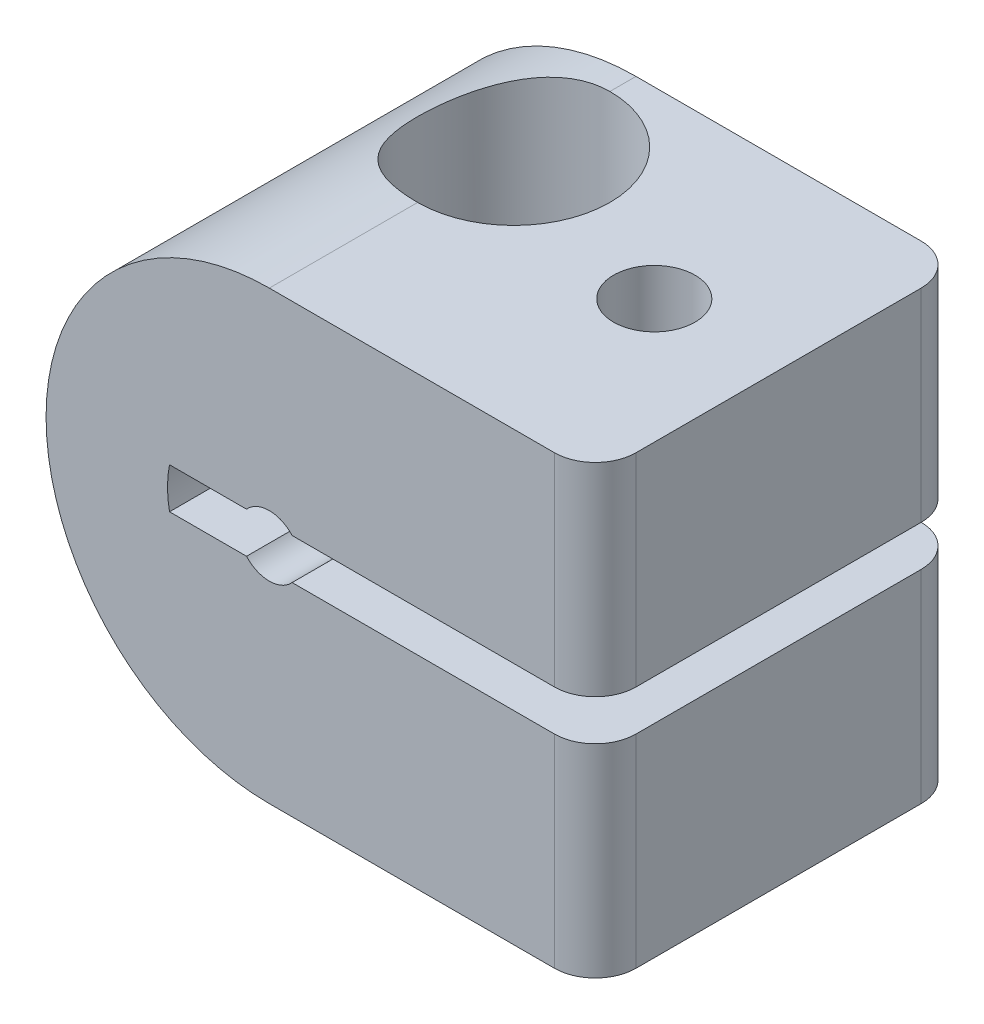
SolidWorks part; units mm, degrees
ref_plane "WL" through (0, 0, 0) normal (0, 0, 1) x (1, 0, 0)
ref_plane "BL" through (0, 0, 0) normal (0, 1, 0) x (1, 0, 0)
ref_plane "STA" through (0, 0, 0) normal (1, 0, 0) x (0, 0, -1)
sketch "Sketch1" plane through (0, 0, 0) normal (0, 0, 1) x (1, 0, 0)
  line L1 (0, 6.9596) -> (10.16, 6.9596)
  line L3 (10.16, 6.9596) -> (10.16, -6.9596)
  line L4 (0, -6.9596) -> (10.16, -6.9596)
  arc A1 (0, 6.9596) -> (0, -6.9596) centre (0, 0) ccw
  dimension "D4" = 13.9192
extrude "Boss-Extrude1" add sketch "Sketch1" along normal blind 5.08
sketch "Sketch6" plane through (0, 0, 5.08) normal (0, 0, 1) x (1, 0, 0)
  circle A0 centre (0, 0) radius 0.9525
  dimension "D1" = 1.905
extrude "Cut-Extrude4" cut sketch "Sketch6" against normal blind 8.89
sketch "Sketch2" plane through (0, 0, 0) normal (0, 0, -1) x (-1, 0, 0)
  line L1 (0, 0) -> (12.8833, 0) construction
  line L4 (-10.16, 6.9596) -> (0, 6.9596) construction
  line L5 (-10.16, -6.9596) -> (-10.16, 6.9596) construction
  line L6 (0, -6.9596) -> (-10.16, -6.9596) construction
  line L7 (-10.16, 6.9596) -> (0, 6.9596)
  line L8 (-10.16, -6.9596) -> (-10.16, 6.9596)
  line L9 (0, -6.9596) -> (-10.16, -6.9596)
  arc A0 (0, -6.9596) -> (0, 6.9596) centre (0, 0) ccw
  arc A3 (0, -6.9596) -> (0, 6.9596) centre (0, 0) ccw construction
extrude "Boss-Extrude2" add sketch "Sketch2" along normal blind 6.35
sketch "Sketch7" plane through (0, 0, -6.35) normal (0, 0, 1) x (1, 0, 0)
  line L1 (0, 0) -> (12.8833, 0) construction
  circle A0 centre (0, 0) radius 3.175
  dimension "D1" = 6.35
extrude "Cut-Extrude5" cut sketch "Sketch7" along normal blind 7.62
fillet "Fillet1" radius 1.27 2 edges at (10.16, 0, -6.35) (10.16, 0, 5.08)
sketch "Sketch4" plane through (0, 0, -6.35) normal (0, 0, 1) x (1, 0, 0)
  line L0 (11.782, 0) -> (3.1496, 0) construction
  line L1 (10.16, -6.9596) -> (10.16, 6.9596) construction
  line L2 (10.16, 0.635) -> (-3.1109, 0.635)
  line L3 (10.16, 0.635) -> (10.16, -0.635)
  line L4 (10.16, -0.635) -> (-3.1109, -0.635)
  line L10 (-1.905, 0) -> (-10.5328, 0) construction
  circle A3 centre (0, 0) radius 3.175 construction
  arc A4 (-3.1109, 0.635) -> (-3.1109, -0.635) centre (0, 0) ccw
  dimension "D1" = 1.27
extrude "Cut-Extrude2" cut sketch "Sketch4" along normal through all
sketch "Sketch5" plane through (0, 6.9596, 0) normal (0, 1, 0) x (1, 0, 0)
  line L1 (3.1109, -1.27) -> (3.1109, 6.35) construction
  line L2 (3.1109, -1.27) -> (3.1109, 6.35) construction
  line L4 (10.16, -3.81) -> (10.16, 5.08)
  line L5 (8.89, 6.35) -> (0, 6.35)
  line L6 (0, 6.35) -> (0, -5.08)
  line L7 (0, -5.08) -> (8.89, -5.08)
  line L8 (10.16, -3.81) -> (10.16, 5.08) construction
  line L9 (8.89, 6.35) -> (0, 6.35) construction
  line L10 (0, 6.35) -> (0, -5.08) construction
  line L11 (0, -5.08) -> (8.89, -5.08) construction
  line L14 (0.71, 0.635) -> (10.16, 0.635) construction
  line L16 (0.71, -5.08) -> (0.71, -1.27) construction
  line L18 (0.71, -5.08) -> (0.71, 6.35) construction
  circle A1 centre (6.2859, 0.635) radius 1.27
  arc A4 (10.16, 5.08) -> (8.89, 6.35) centre (8.89, 5.08) ccw
  arc A5 (8.89, -5.08) -> (10.16, -3.81) centre (8.89, -3.81) ccw
  dimension "D2" = 2.54
  dimension "D3" = 3.175
  dimension "D4" = 3.8741
  dimension "D1" = 0
extrude "Cut-Extrude3" cut sketch "Sketch5" against normal through all
sketch "Sketch8" plane through (0, 6.9596, 0) normal (0, 1, 0) x (1, 0, 0)
  line L0 (0, -5.08) -> (0, 6.35) construction
  line L1 (0, 6.35) -> (8.89, 6.35) construction
  circle A0 centre (0, 2.54) radius 2.9972
  dimension "D1" = 5.9944
  dimension "D2" = 3.81
extrude "Cut-Extrude6" cut sketch "Sketch8" against normal up to surface (6.9596 mm away)
